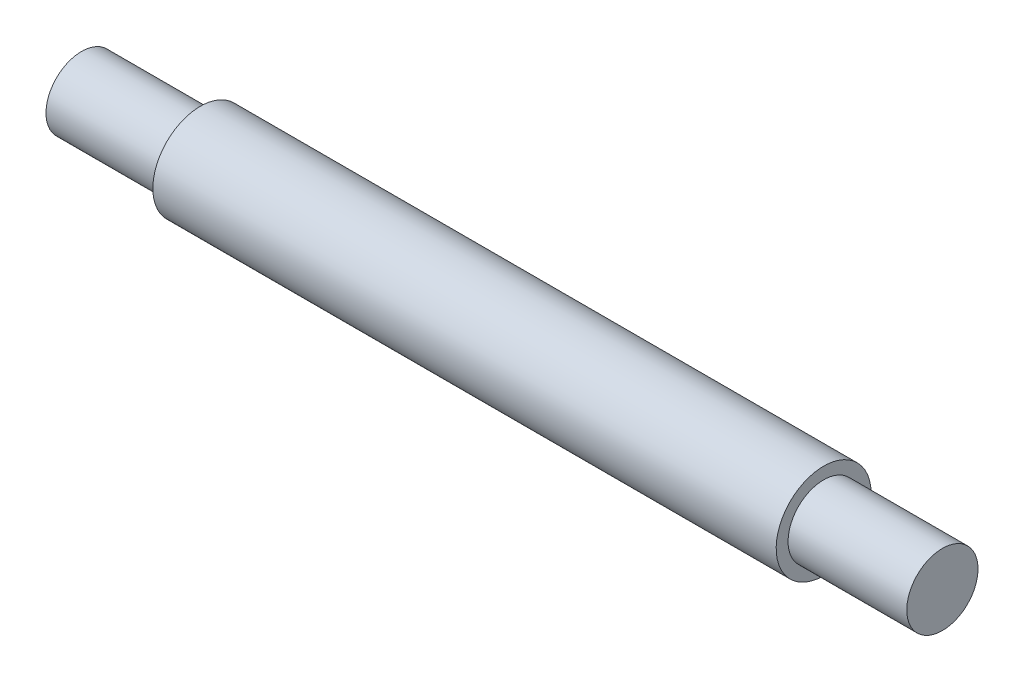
SolidWorks part; units mm, degrees
ref_plane "Plan de face" through (0, 0, 0) normal (0, 0, 1) x (1, 0, 0)
ref_plane "Plan de dessus" through (0, 0, 0) normal (0, 1, 0) x (1, 0, 0)
ref_plane "Plan de droite" through (0, 0, 0) normal (1, 0, 0) x (0, 0, -1)
sketch "Esquisse1" plane through (0, 0, 0) normal (0, 0, 1) x (1, 0, 0)
  line L0 (-36.25, 0) -> (36.25, 0)
  line L1 (36.25, 0) -> (36.25, 3)
  line L2 (36.25, 3) -> (26.25, 3)
  line L3 (26.25, 3) -> (26.25, 4)
  line L4 (26.25, 4) -> (-26.25, 4)
  line L5 (0, 4) -> (0, 0) construction
  line L6 (-26.25, 3) -> (-26.25, 4)
  line L7 (-36.25, 3) -> (-26.25, 3)
  line L8 (-36.25, 0) -> (-36.25, 3)
  dimension "D1" = 3
  dimension "D2" = 4
  dimension "D3" = 26.25
  dimension "D4" = 10
revolve "Révolution1" add sketch "Esquisse1" angle 360 about L0
